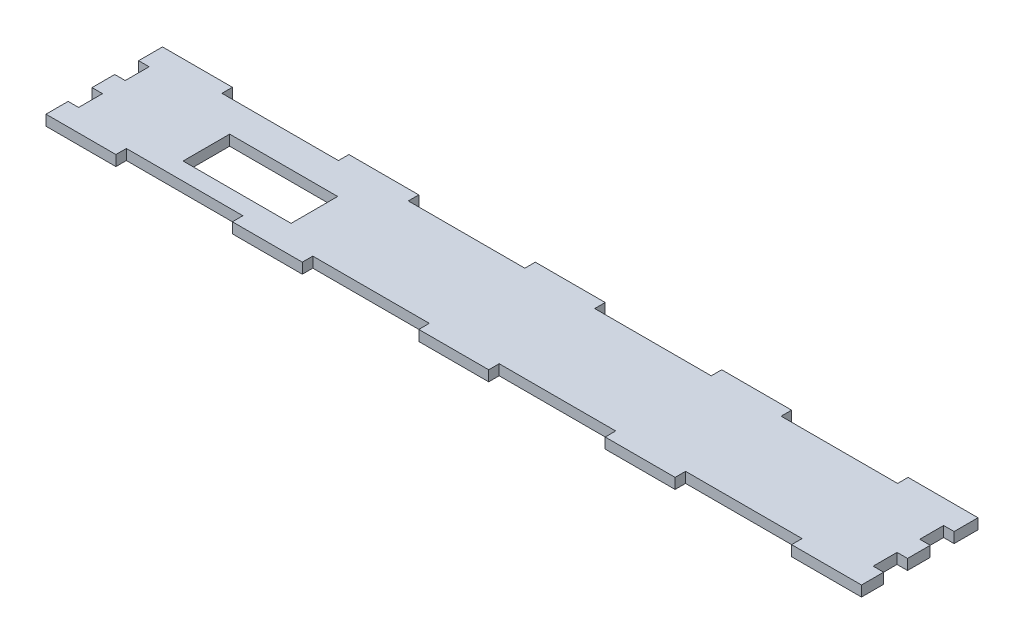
SolidWorks part; units mm, degrees
ref_plane "Front Plane" through (0, 0, 0) normal (0, 0, 1) x (1, 0, 0)
ref_plane "Top Plane" through (0, 0, 0) normal (0, 1, 0) x (1, 0, 0)
ref_plane "Right Plane" through (0, 0, 0) normal (1, 0, 0) x (0, 0, -1)
sketch "Sketch1" plane through (0, 0, 0) normal (0, 1, 0) x (1, 0, 0)
  line L1 (-350, 50) -> (350, 50)
  line L2 (-350, 50) -> (-350, 29.5)
  line L3 (-350, -50) -> (350, -50)
  line L4 (350, 50) -> (350, 29.5)
  line L5 (-350, 50) -> (350, -50) construction
  line L6 (-350, -50) -> (350, 50) construction
  line L7 (-350, 29.5) -> (-341, 29.5)
  line L9 (-350, 9) -> (-341, 9)
  line L10 (-341, 29.5) -> (-341, 9)
  line L11 (-350, -10.5) -> (-341, -10.5)
  line L12 (-341, -10.5) -> (-341, -31)
  line L13 (-350, -31) -> (-341, -31)
  line L14 (0, 131.3384) -> (0, -134.3722) construction
  line L15 (350, 9) -> (341, 9)
  line L16 (341, 29.5) -> (341, 9)
  line L17 (350, 29.5) -> (341, 29.5)
  line L19 (350, -10.5) -> (341, -10.5)
  line L20 (341, -10.5) -> (341, -31)
  line L21 (350, -31) -> (341, -31)
  line L23 (350, 9) -> (350, -10.5)
  line L24 (350, -31) -> (350, -50)
  line L26 (-350, -31) -> (-350, -50)
  line L27 (-350, 9) -> (-350, -10.5)
  point P0 (0, 0)
  dimension "D1" = 100
  dimension "D2" = 700
  dimension "D3" = 20.5
  dimension "D4" = 20.5
  dimension "D6" = 9
  dimension "D5" = 2
extrude "Boss-Extrude1" add sketch "Sketch1" along normal blind 9
sketch "Sketch2" plane through (0, 9, 0) normal (0, 1, 0) x (1, 0, 0)
  line L0 (350, 50) -> (-350, 50) construction
  line L1 (-290, 50) -> (-190, 50)
  line L2 (-290, 50) -> (-290, 41)
  line L3 (-290, 41) -> (-190, 41)
  line L4 (-190, 50) -> (-190, 41)
  line L25 (-359.8206, 0) -> (369.5266, 0) construction
  line L50 (-130, 50) -> (-130, 41)
  line L51 (-130, 50) -> (-30, 50)
  line L52 (-30, 50) -> (-30, 41)
  line L53 (-130, 41) -> (-30, 41)
  line L54 (30, 50) -> (30, 41)
  line L55 (30, 50) -> (130, 50)
  line L56 (130, 50) -> (130, 41)
  line L57 (30, 41) -> (130, 41)
  line L58 (190, 50) -> (190, 41)
  line L59 (190, 50) -> (290, 50)
  line L60 (290, 50) -> (290, 41)
  line L61 (190, 41) -> (290, 41)
  line L62 (350, 29.5) -> (350, 50) construction
  line L63 (190, -50) -> (290, -50)
  line L64 (290, -50) -> (290, -41)
  line L65 (190, -41) -> (290, -41)
  line L66 (190, -50) -> (190, -41)
  line L67 (30, -50) -> (130, -50)
  line L68 (130, -50) -> (130, -41)
  line L69 (30, -41) -> (130, -41)
  line L70 (30, -50) -> (30, -41)
  line L71 (-130, -50) -> (-30, -50)
  line L72 (-30, -50) -> (-30, -41)
  line L73 (-130, -41) -> (-30, -41)
  line L74 (-130, -50) -> (-130, -41)
  line L75 (-290, -41) -> (-190, -41)
  line L76 (-190, -50) -> (-190, -41)
  line L77 (-290, -50) -> (-190, -50)
  line L78 (-290, -50) -> (-290, -41)
  dimension "D1" = 60
  dimension "D2" = 100
  dimension "D4" = 9
  dimension "D3" = 60
  dimension "D5" = 4
extrude "Cut-Extrude1" cut sketch "Sketch2" against normal blind 9
sketch "Sketch5" plane through (0, 9, 0) normal (0, 1, 0) x (1, 0, 0)
  line L0 (-190, -41) -> (-290, -41) construction
  line L1 (-256.3445, 14) -> (-163.6445, 14)
  line L2 (-256.3445, 14) -> (-256.3445, -26)
  line L3 (-256.3445, -26) -> (-163.6445, -26)
  line L4 (-163.6445, 14) -> (-163.6445, -26)
  dimension "D1" = 92.7
  dimension "D2" = 40
  dimension "D3" = 15
extrude "Cut-Extrude2" cut sketch "Sketch5" against normal through all
